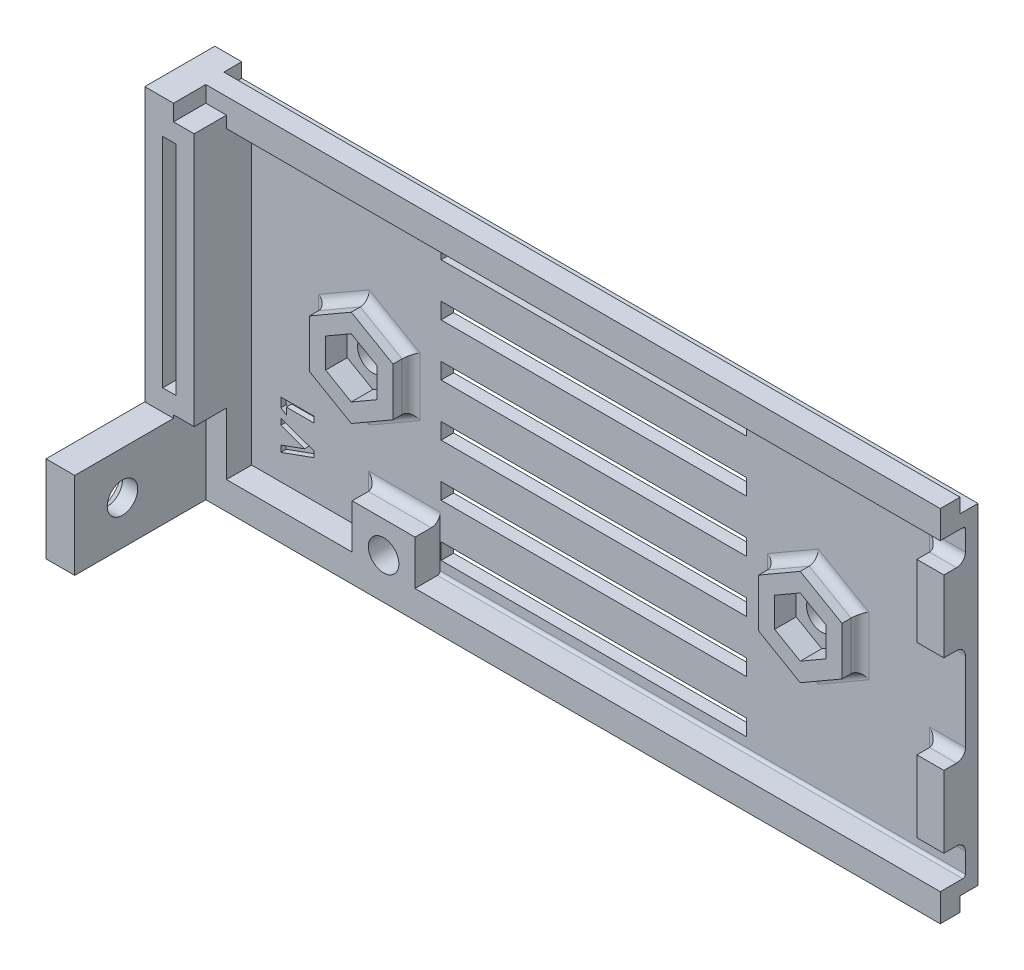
SolidWorks part; units mm, degrees
ref_plane "Front Plane" through (0, 0, 0) normal (0, 0, 1) x (1, 0, 0)
ref_plane "Top Plane" through (0, 0, 0) normal (0, 1, 0) x (1, 0, 0)
ref_plane "Right Plane" through (0, 0, 0) normal (1, 0, 0) x (0, 0, -1)
sketch "Sketch1" plane through (0, 0, 0) normal (0, 0, 1) x (1, 0, 0)
  line L1 (-15.75, 6.925) -> (67.05, 6.925)
  line L2 (-15.75, 6.925) -> (-15.75, -33.125)
  line L3 (-15.75, -33.125) -> (67.05, -33.125)
  line L4 (67.05, 6.925) -> (67.05, -33.125)
  dimension "D1" = 40.05
  dimension "D2" = 82.8
extrude "Boss-Extrude1" add sketch "Sketch1" along normal blind 1.4
ref_plane "Plane1" through (0, 0, 1.4) normal (0, 0, 1) x (1, 0, 0)
sketch "Sketch5" plane through (0, 0, 0) normal (0, 0, 1) x (1, 0, 0)
  line L0 (-15.75, 6.925) -> (-15.75, -33.125) construction
  line L1 (-15.75, 6.925) -> (-17.95, 6.925)
  line L2 (-15.75, 6.925) -> (-15.75, -33.125)
  line L3 (-15.75, -33.125) -> (-17.95, -33.125)
  line L4 (-17.95, 6.925) -> (-17.95, -33.125)
  dimension "D1" = 2.2
extrude "Boss-Extrude3" add sketch "Sketch5" along normal blind 7.8
ref_plane "Plane2" through (0, 0, 7.8) normal (0, 0, 1) x (1, 0, 0)
sketch "Sketch7" plane through (0, 0, 0) normal (0, 0, 1) x (1, 0, 0)
  line L0 (67.05, 6.925) -> (-17.95, 6.925) construction
  line L1 (8.65, -3.675) -> (42.65, -3.675)
  line L2 (42.65, 2.125) -> (8.65, 2.125)
  line L3 (42.65, 2.125) -> (42.65, 0.325)
  line L4 (42.65, 0.325) -> (8.65, 0.325)
  line L5 (8.65, 2.125) -> (8.65, 0.325)
  line L6 (8.65, -3.675) -> (8.65, -5.475)
  line L7 (8.65, -5.475) -> (42.65, -5.475)
  line L8 (42.65, -3.675) -> (42.65, -5.475)
  line L9 (8.65, -21.075) -> (42.65, -21.075)
  line L10 (8.65, -21.075) -> (8.65, -22.875)
  line L11 (8.65, -22.875) -> (42.65, -22.875)
  line L12 (42.65, -21.075) -> (42.65, -22.875)
  line L14 (67.05, -33.125) -> (67.05, 6.925) construction
  line L15 (8.65, -9.475) -> (42.65, -9.475)
  line L16 (8.65, -9.475) -> (8.65, -11.275)
  line L17 (8.65, -11.275) -> (42.65, -11.275)
  line L18 (42.65, -9.475) -> (42.65, -11.275)
  line L19 (8.65, -15.275) -> (42.65, -15.275)
  line L20 (8.65, -15.275) -> (8.65, -17.075)
  line L21 (8.65, -17.075) -> (42.65, -17.075)
  line L22 (42.65, -15.275) -> (42.65, -17.075)
  line L25 (42.65, -26.875) -> (8.65, -26.875)
  line L26 (42.65, -26.875) -> (42.65, -28.675)
  line L27 (42.65, -28.675) -> (8.65, -28.675)
  line L28 (8.65, -26.875) -> (8.65, -28.675)
  line L29 (-17.95, 6.925) -> (-17.95, -33.125) construction
  dimension "D1" = 4.8
  dimension "D2" = 1.8
  dimension "D3" = 1.8
  dimension "D4" = 1.8
  dimension "D5" = 4
  dimension "D6" = 4
  dimension "D7" = 1.8
  dimension "D8" = 4
  dimension "D9" = 1.8
  dimension "D10" = 4
  dimension "D11" = 24.4
  dimension "D12" = 26.6
  dimension "D13" = 1.8
  dimension "D14" = 4
extrude "Cut-Extrude1" cut sketch "Sketch7" along normal blind 2
ref_plane "Plane3" through (-17.95, 0, 0) normal (-1, 0, 0) x (0, 0, 1)
sketch "Sketch11" plane through (0, 0, 1.4) normal (0, 0, 1) x (1, 0, 0)
  line L0 (67.05, -33.125) -> (67.05, 6.925) construction
  line L1 (-17.95, -33.125) -> (67.05, -33.125)
  line L2 (-17.95, -33.125) -> (-17.95, -30.025)
  line L3 (-17.95, -30.025) -> (67.05, -30.025)
  line L4 (67.05, -33.125) -> (67.05, -30.025)
  line L5 (-15.75, -33.125) -> (67.05, -33.125) construction
  line L6 (-17.95, 6.925) -> (67.05, 6.925)
  line L7 (-17.95, 6.925) -> (-17.95, 3.825)
  line L8 (-17.95, 3.825) -> (67.05, 3.825)
  line L9 (67.05, 6.925) -> (67.05, 3.825)
  dimension "D1" = 3.1
  dimension "D2" = 3.1
extrude "Boss-Extrude4" add sketch "Sketch11" along normal blind 2.8
sketch "Sketch9" plane through (0, 0, 0) normal (0, 0, 1) x (1, 0, 0)
  line L0 (67.05, -33.125) -> (67.05, 6.925) construction
  line L1 (-17.95, -33.125) -> (67.05, -33.125)
  line L2 (-17.95, -33.125) -> (-17.95, -31.525)
  line L3 (-17.95, -31.525) -> (67.05, -31.525)
  line L4 (67.05, -33.125) -> (67.05, -31.525)
  line L5 (-17.95, 6.925) -> (-17.95, -33.125) construction
  line L6 (67.05, 6.925) -> (-17.95, 6.925)
  line L7 (67.05, 6.925) -> (67.05, 5.325)
  line L8 (67.05, 5.325) -> (-17.95, 5.325)
  line L9 (-17.95, 6.925) -> (-17.95, 5.325)
  dimension "D1" = 1.6
  dimension "D2" = 1.6
extrude "Cut-Extrude4" cut sketch "Sketch9" along normal blind 2
hole_wizard "CSK for M3 Flat Head Machine Screw1" positions "Sketch12" profile "Sketch13" countersink size "M3" standard "ANSI Metric"
sketch "Sketch12" plane through (0, 0, 0) normal (0, 0, -1) x (-1, 0, 0)
  point P0 (-5.05, -28.575)
sketch "Sketch13" plane through (5.05, -28.575, 0) normal (1, 0, 0) x (0, 1, 0)
  line L0 (0, 0) -> (0, 15.0215)
  line L1 (0, 15.0215) -> (1.7, 14)
  line L2 (1.7, 14) -> (1.7, 1.3)
  line L3 (1.7, 1.3) -> (3, 0)
  line L5 (3, 0) -> (0, 0)
  line L6 (-1.7, 1.3) -> (-3, 0) construction
  line L10 (0, 15.0215) -> (-1.7, 14) construction
  line L11 (0, -6.35) -> (0, 107.95) construction
  dimension "Hole Dia." = 3.4
  dimension "Hole Depth" = 14
  dimension "Near C'Sink Dia." = 6
  dimension "Near C'Sink Angle" = 90
  dimension "Drill Angle" = 118
sketch "Sketch18" plane through (0, 0, 1.4) normal (0, 0, 1) x (1, 0, 0)
  line L0 (67.05, 6.925) -> (-15.75, 6.925) construction
  line L1 (-15.95, -33.125) -> (-12.45, -33.125)
  line L2 (-15.95, -33.125) -> (-15.95, 6.925)
  line L3 (-15.95, 6.925) -> (-12.45, 6.925)
  line L4 (-12.45, -33.125) -> (-12.45, 6.925)
  line L5 (-17.95, 6.925) -> (-17.95, -33.125) construction
  line L6 (-15.75, -33.125) -> (67.05, -33.125) construction
  dimension "D1" = 3.5
  dimension "D2" = 2
extrude "Boss-Extrude7" add sketch "Sketch18" along normal up to surface (6.4 mm away)
sketch "Sketch20" plane through (0, 0, 0) normal (0, 0, 1) x (1, 0, 0)
  line L1 (8.65, -21.075) -> (5.65, -21.075)
  line L2 (8.65, -21.075) -> (8.65, -11.275)
  line L3 (8.65, -11.275) -> (5.65, -11.275)
  line L4 (5.65, -21.075) -> (5.65, -11.275)
  dimension "D1" = 3
ref_plane "Plane4" through (67.05, 0, 0) normal (1, 0, 0) x (0, 0, -1)
fillet "Fillet2" radius 0.3 2 edges at (27.3, 3.825, 1.4) (36.4937, -30.025, 1.4)
ref_plane "Plane5" through (0, 0, 7.8) normal (0, 0, 1) x (1, 0, 0)
sketch "Sketch23" plane through (0, 0, 7.8) normal (0, 0, 1) x (1, 0, 0)
  line L0 (-12.45, -33.125) -> (-12.45, 6.925) construction
  line L1 (-12.45, 5.125) -> (-14.75, 5.125)
  line L2 (-12.45, 5.125) -> (-12.45, 6.925)
  line L3 (-12.45, 6.925) -> (-14.75, 6.925)
  line L4 (-14.75, 5.125) -> (-14.75, 6.925)
  line L5 (-12.45, 6.925) -> (-17.95, 6.925) construction
  line L6 (-17.95, 6.925) -> (-17.95, -33.125) construction
  line L7 (-17.95, 6.925) -> (-17.95, -33.125) construction
  line L8 (-12.45, -33.125) -> (-17.95, -33.125) construction
  line L9 (-12.45, -33.125) -> (-14.75, -33.125)
  line L10 (-12.45, -33.125) -> (-12.45, -23.125)
  line L11 (-12.45, -23.125) -> (-14.75, -23.125)
  line L13 (-14.75, -33.125) -> (-14.75, -23.125)
  dimension "D1" = 3.2
  dimension "D2" = 1.8
  dimension "D3" = 10
  dimension "D4" = 3.2
sketch "Sketch25" plane through (0, 0, 1.4) normal (0, 0, 1) x (1, 0, 0)
  line L1 (1.55, -30.525) -> (8.55, -30.525)
  line L2 (1.55, -30.525) -> (1.55, -25.075)
  line L3 (1.55, -25.075) -> (8.55, -25.075)
  line L4 (8.55, -30.525) -> (8.55, -25.075)
  circle A0 centre (5.05, -28.575) radius 1.7
  dimension "D4" = 5.45
  dimension "D5" = 3.4
  dimension "D1" = 3.5
  dimension "D2" = 3.5
  dimension "D3" = 3.5
extrude "Boss-Extrude8" add sketch "Sketch25" along normal blind 2.8
extrude "Cut-Extrude11" cut sketch "Sketch23" against normal up to surface (3.6 mm away)
sketch "Sketch26" plane through (0, 0, 1.4) normal (0, 0, 1) x (1, 0, 0)
  line L1 (-12.45, 6.925) -> (-15.95, 6.925)
  line L2 (-12.45, 6.925) -> (-12.45, 5.325)
  line L3 (-12.45, 5.325) -> (-15.95, 5.325)
  line L4 (-15.95, 6.925) -> (-15.95, 5.325)
  line L5 (-12.45, -33.125) -> (-15.95, -33.125)
  line L6 (-12.45, -33.125) -> (-12.45, -31.525)
  line L7 (-12.45, -31.525) -> (-15.95, -31.525)
  line L8 (-15.95, -33.125) -> (-15.95, -31.525)
extrude "Cut-Extrude12" cut sketch "Sketch26" along normal up to surface (0.6 mm away)
sketch "Sketch29" plane through (67.05, 0, 0) normal (1, 0, 0) x (0, 0, -1)
  line L1 (-4.2, -33.125) -> (-3.2, -33.125)
  line L2 (-4.2, -33.125) -> (-4.2, 6.925)
  line L3 (-4.2, 6.925) -> (-3.2, 6.925)
  line L4 (-3.2, -33.125) -> (-3.2, 6.925)
  dimension "D1" = 1
sketch "Sketch30" plane through (0, 0, 7.8) normal (0, 0, 1) x (1, 0, 0)
  line L0 (-17.95, 6.925) -> (-17.95, -33.125) construction
  line L1 (-15.95, 3.125) -> (-14.45, 3.125)
  line L2 (-15.95, 3.125) -> (-15.95, -21.125)
  line L3 (-15.95, -21.125) -> (-14.45, -21.125)
  line L4 (-14.45, 3.125) -> (-14.45, -21.125)
  line L5 (-14.75, 5.125) -> (-12.45, 5.125) construction
  line L6 (-12.45, 5.125) -> (-12.45, -23.125) construction
  line L7 (-14.75, -23.125) -> (-12.45, -23.125) construction
  dimension "D1" = 2
  dimension "D2" = 2
  dimension "D3" = 2
  dimension "D4" = 2
extrude "Cut-Extrude16" cut sketch "Sketch30" against normal up to surface (6.4 mm away)
sketch "Sketch31" plane through (0, 0, 0) normal (0, 0, 1) x (1, 0, 0)
  line L0 (-17.95, 5.325) -> (-17.95, -31.525) construction
  circle A0 centre (0.65, -13.1) radius 1.7
  circle A1 centre (50.65, -13.1) radius 1.7
  point P7 (-17.95, -13.1)
  dimension "D1" = 3.4
  dimension "D2" = 3.4
  dimension "D3" = 18.6
  dimension "D4" = 50
extrude "Cut-Extrude17" cut sketch "Sketch31" along normal blind 1.6
ref_plane "Plane6" through (0, 0, 1) normal (0, 0, -1) x (-1, 0, 0)
sketch "Sketch32" plane through (0, 0, 1) normal (0, 0, -1) x (-1, 0, 0)
  line L1 (-0.65, -16.3909) -> (2.2, -14.7454)
  line L2 (2.2, -14.7454) -> (2.2, -11.4546)
  line L3 (2.2, -11.4546) -> (-0.65, -9.8091)
  line L4 (-0.65, -9.8091) -> (-3.5, -11.4546)
  line L5 (-3.5, -11.4546) -> (-3.5, -14.7454)
  line L6 (-3.5, -14.7454) -> (-0.65, -16.3909)
  line L7 (-53.5, -14.7454) -> (-50.65, -16.3909)
  line L8 (-50.65, -16.3909) -> (-47.8, -14.7454)
  line L9 (-47.8, -14.7454) -> (-47.8, -11.4546)
  line L10 (-47.8, -11.4546) -> (-50.65, -9.8091)
  line L11 (-50.65, -9.8091) -> (-53.5, -11.4546)
  line L12 (-53.5, -11.4546) -> (-53.5, -14.7454)
  circle A0 centre (-0.65, -13.1) radius 2.85 construction
  circle A1 centre (-50.65, -13.1) radius 2.85 construction
  dimension "D1" = 5.7
  dimension "D2" = 5.7
extrude "Cut-Extrude18" cut sketch "Sketch32" against normal blind 0.4
sketch "Sketch33" plane through (0, 0, 1) normal (0, 0, -1) x (-1, 0, 0)
  line L1 (-3.5, -11.4546) -> (-3.5, -14.7454)
  line L2 (-3.5, -14.7454) -> (-0.65, -16.3909)
  line L3 (-0.65, -16.3909) -> (2.2, -14.7454)
  line L4 (2.2, -14.7454) -> (2.2, -11.4546)
  line L5 (2.2, -11.4546) -> (-0.65, -9.8091)
  line L6 (-0.65, -9.8091) -> (-3.5, -11.4546)
  line L7 (-53.5, -11.4546) -> (-53.5, -14.7454)
  line L8 (-53.5, -14.7454) -> (-50.65, -16.3909)
  line L9 (-50.65, -16.3909) -> (-47.8, -14.7454)
  line L10 (-47.8, -14.7454) -> (-47.8, -11.4546)
  line L11 (-47.8, -11.4546) -> (-50.65, -9.8091)
  line L12 (-50.65, -9.8091) -> (-53.5, -11.4546)
  line L14 (-53.5, -11.4546) -> (-53.5, -14.7454) construction
  line L15 (-53.5, -11.4546) -> (-53.5, -14.7454) construction
  circle A0 centre (-0.65, -13.1) radius 2.85 construction
  circle A1 centre (-50.65, -13.1) radius 2.85 construction
extrude "Extrude-Thin1" add sketch "Sketch33" against normal blind 2.4 thin
fillet "Fillet3" radius 1 14 edges at (46, -13.1, 1.4) (48.325, -17.127, 1.4) (52.975, -17.127, 1.4) (55.3, -13.1, 1.4) (48.325, -9.073, 1.4) (52.975, -9.073, 1.4) (-4, -13.1, 1.4) (-1.675, -9.073, 1.4) (2.975, -9.073, 1.4) (5.3, -13.1, 1.4) (2.975, -17.127, 1.4) (-1.675, -17.127, 1.4) (1.55, -27.55, 1.4) (5.05, -25.075, 1.4)
sketch "Sketch34" plane through (0, 0, 1.4) normal (0, 0, 1) x (1, 0, 0)
  line L0 (67.05, -29.725) -> (67.05, 3.525) construction
  line L1 (67.05, -26.525) -> (64.05, -26.525)
  line L2 (67.05, -26.525) -> (67.05, -18.525)
  line L3 (67.05, -18.525) -> (64.05, -18.525)
  line L4 (64.05, -26.525) -> (64.05, -18.525)
  line L6 (67.05, -7.675) -> (64.05, -7.675)
  line L7 (67.05, -7.675) -> (67.05, 0.325)
  line L8 (67.05, 0.325) -> (64.05, 0.325)
  line L9 (64.05, -7.675) -> (64.05, 0.325)
  line L11 (-12.45, 3.825) -> (67.05, 3.825) construction
  line L12 (67.05, -30.025) -> (8.55, -30.025) construction
  point P12 (65.55, 0.325)
  dimension "D1" = 3.5
  dimension "D2" = 8
  dimension "D3" = 3.5
  dimension "D4" = 8
  dimension "D5" = 3
  dimension "D6" = 3
extrude "Boss-Extrude9" add sketch "Sketch34" along normal blind 2.4
fillet "Fillet4" radius 1 6 edges at (65.55, 0.325, 1.4) (65.55, -7.675, 1.4) (64.05, -3.675, 1.4) (65.55, -18.525, 1.4) (64.05, -22.525, 1.4) (65.55, -26.525, 1.4)
ref_plane "Plane7" through (0, 0, 2) normal (0, 0, -1) x (-1, 0, 0)
sketch "Sketch36" plane through (-17.95, 0, 0) normal (-1, 0, 0) x (0, 0, 1)
  line L1 (0, 5.325) -> (2, 5.325)
  line L2 (0, 5.325) -> (0, 6.925)
  line L3 (0, 6.925) -> (2, 6.925)
  line L4 (2, 5.325) -> (2, 6.925)
  line L5 (0, -31.525) -> (2, -31.525)
  line L6 (0, -31.525) -> (0, -33.125)
  line L7 (0, -33.125) -> (2, -33.125)
  line L8 (2, -31.525) -> (2, -33.125)
extrude "Boss-Extrude11" add sketch "Sketch36" against normal blind 3
sketch "Sketch37" plane through (0, 0, 7.8) normal (0, 0, 1) x (1, 0, 0)
  line L0 (-17.95, 6.925) -> (-17.95, -33.125) construction
  line L1 (-14.75, -33.125) -> (-17.95, -33.125)
  line L2 (-14.75, -33.125) -> (-14.75, -23.475)
  line L3 (-14.75, -23.475) -> (-17.95, -23.475)
  line L4 (-17.95, -33.125) -> (-17.95, -23.475)
  dimension "D1" = 9.65
extrude "Boss-Extrude12" add sketch "Sketch37" along normal blind 11
sketch "Sketch38" plane through (-17.95, 0, 0) normal (-1, 0, 0) x (0, 0, 1)
  circle A0 centre (13.4832, -28.275) radius 1.7
  dimension "D1" = 3.4
extrude "Cut-Extrude19" cut sketch "Sketch38" against normal blind 5
hole_wizard "CSK for M3 Flat Head Machine Screw2" positions "Sketch39" profile "Sketch40" countersink size "M3" standard "ANSI Metric"
sketch "Sketch39" plane through (-17.95, 0, 0) normal (-1, 0, 0) x (0, 0, 1)
  point P0 (13.4832, -28.275)
sketch "Sketch40" plane through (-17.95, -28.275, 13.4832) normal (0, 1, 0) x (0, 0, 1)
  line L0 (0, 0) -> (0, 15.0215)
  line L1 (0, 15.0215) -> (1.7, 14)
  line L2 (1.7, 14) -> (1.7, 1.5)
  line L3 (1.7, 1.5) -> (3.2, 0)
  line L5 (3.2, 0) -> (0, 0)
  line L6 (-1.7, 1.5) -> (-3.2, 0) construction
  line L10 (0, 15.0215) -> (-1.7, 14) construction
  line L11 (0, -6.35) -> (0, 107.95) construction
  dimension "Hole Dia." = 3.4
  dimension "Hole Depth" = 14
  dimension "Near C'Sink Dia." = 6.4
  dimension "Near C'Sink Angle" = 90
  dimension "Drill Angle" = 118
ref_plane "Plane8" through (0, 0, 1.4) normal (0, 0, 1) x (1, 0, 0)
sketch "Sketch41" plane through (0, 0, 1.4) normal (0, 0, 1) x (1, 0, 0)
  line L0 (-5.4931, -27.2971) -> (-5.4931, -14.0067) construction
  text T0 "V1" font "Century Gothic" height in points 14
extrude "Cut-Extrude20" cut sketch "Sketch41" against normal blind 0.6
